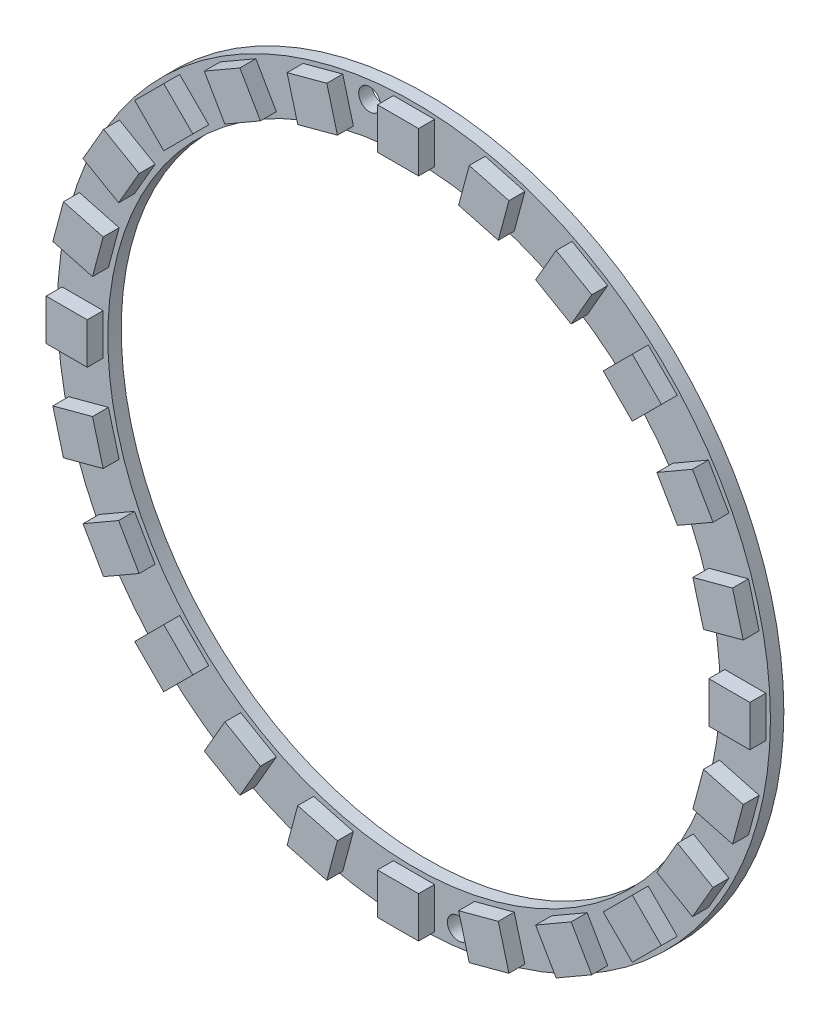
SolidWorks part; units mm, degrees
ref_plane "Ebene vorne" through (0, 0, 0) normal (0, 0, 1) x (1, 0, 0)
ref_plane "Ebene oben" through (0, 0, 0) normal (0, 1, 0) x (1, 0, 0)
ref_plane "Ebene rechts" through (0, 0, 0) normal (1, 0, 0) x (0, 0, -1)
sketch "Skizze1" plane through (0, 0, 0) normal (0, 0, 1) x (1, 0, 0)
  circle A0 centre (0, 0) radius 36.5
  circle A1 centre (0, 0) radius 42.5
  dimension "D1" = 85
  dimension "D2" = 73
extrude "Aufsatz-Linear austragen1" add sketch "Skizze1" along normal blind 1.6
sketch "Skizze2" plane through (0, 0, 1.6) normal (0, 0, 1) x (1, 0, 0)
  line L0 (0, 36.5) -> (0, 42.5) construction
  line L1 (-2.45, 37.05) -> (2.45, 37.05)
  line L2 (-2.45, 37.05) -> (-2.45, 41.95)
  line L3 (-2.45, 41.95) -> (2.45, 41.95)
  line L4 (2.45, 37.05) -> (2.45, 41.95)
  line L5 (-2.45, 37.05) -> (2.45, 41.95) construction
  line L6 (-2.45, 41.95) -> (2.45, 37.05) construction
  circle A0 centre (0, 0) radius 36.5 construction
  circle A1 centre (0, 0) radius 42.5 construction
  point P0 (0, 39.5)
  dimension "D1" = 4.9
extrude "Aufsatz-Linear austragen2" add sketch "Skizze2" along normal blind 1.9
pattern_circular "Kreismuster1" count 24 over 360 about axis through (0, 0, 0) along (0, 0, 1) of "Aufsatz-Linear austragen2"
hole_wizard "Durchgangsloch für M21" positions "Skizze3" profile "Skizze4" hole size "M2" standard "DIN"
sketch "Skizze3" plane through (0, 0, 1.6) normal (0, 0, 1) x (1, 0, 0)
  line L0 (-5.2863, 40.1535) -> (5.2863, -40.1535) construction
  line L1 (0, 42.5) -> (0, 0) construction
  line L2 (0, 0) -> (-4.0685, 30.9032) construction
  circle A0 centre (0, 0) radius 40.5 construction
  circle A1 centre (0, 0) radius 42.5 construction
  point P0 (-5.2863, 40.1535)
  point P2 (5.2863, -40.1535)
  dimension "D1" = 81
  dimension "D2" = 7.5
sketch "Skizze4" plane through (-5.2863, 40.1535, 1.6) normal (1, 0, 0) x (0, -1, 0)
  line L0 (0, 0) -> (0, 1.6)
  line L1 (0, 1.6) -> (1.3, 1.6)
  line L2 (1.3, 1.6) -> (1.3, 0)
  line L5 (1.3, 0) -> (0, 0)
  line L11 (0, -6.35) -> (0, 107.95) construction
  dimension "Bohrerdurchmesser" = 2.6
  dimension "Bohrungstiefe" = 1.6
ref_plane "led-ebene" through (0, 0, 3.5) normal (0, 0, 1) x (1, 0, 0)
